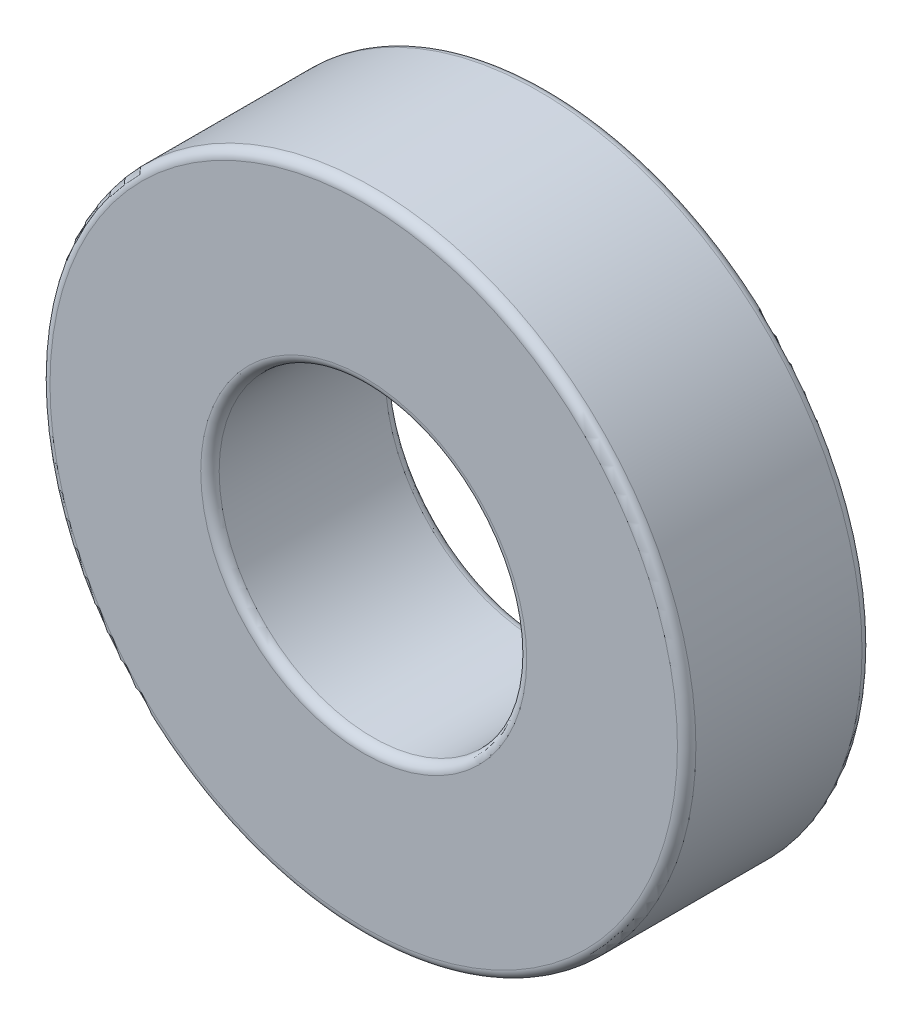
SolidWorks part; units mm, degrees
ref_plane "Face" through (0, 0, 0) normal (0, 0, 1) x (1, 0, 0)
ref_plane "Dessus" through (0, 0, 0) normal (0, 1, 0) x (1, 0, 0)
ref_plane "Droite" through (0, 0, 0) normal (1, 0, 0) x (0, 0, -1)
sketch "E_corps" plane through (0, 0, 0) normal (1, 0, 0) x (0, 0, -1)
  line L0 (-33.1757, 0) -> (55.1783, 0) construction
  line L1 (0.6, 21) -> (11.4, 21)
  line L2 (12, 20.4) -> (12, 10.6)
  line L3 (11.4, 10) -> (0.6, 10)
  line L4 (0, 10.6) -> (0, 20.4)
  line L5 (0, 50) -> (0, -50) construction
  arc A0 (0, 20.4) -> (0.6, 21) centre (0.6, 20.4) cw
  arc A1 (12, 20.4) -> (11.4, 21) centre (11.4, 20.4) ccw
  arc A2 (0.6, 10) -> (0, 10.6) centre (0.6, 10.6) cw
  arc A3 (12, 10.6) -> (11.4, 10) centre (11.4, 10.6) cw
revolve "corps" add sketch "E_corps" angle 360 about L0
sketch "E_symbole" plane through (0, 0, 0) normal (1, 0, 0) x (0, 0, -1)
  line L0 (-3.4482, 15.5) -> (19.8356, 15.5) construction
  line L1 (-33.1757, 0) -> (55.1783, 0) construction
  line L2 (1.2, 15.495) -> (1.2, 15.505)
  line L3 (1.2, 15.505) -> (5.995, 15.505)
  line L4 (1.2, 15.495) -> (5.995, 15.495)
  line L5 (5.995, 15.505) -> (5.995, 18.25)
  line L6 (5.995, 15.495) -> (5.995, 12.75)
  line L7 (5.995, 18.25) -> (6.005, 18.25)
  line L8 (5.995, 12.75) -> (6.005, 12.75)
  line L9 (6, 16.6578) -> (6, 5.8829) construction
  line L10 (6.005, 15.505) -> (6.005, 18.25)
  line L11 (10.8, 15.505) -> (6.005, 15.505)
  line L12 (10.8, 15.495) -> (10.8, 15.505)
  line L13 (10.8, 15.495) -> (6.005, 15.495)
  line L14 (6.005, 15.495) -> (6.005, 12.75)
  line L15 (12, 20.4) -> (12, 10.6) construction
  line L17 (0.6, 21) -> (11.4, 21) construction
  line L18 (0, 10.6) -> (0, 20.4) construction
  line L19 (-8.3118, 0) -> (25.8663, 0) construction
  point P7 (1.2, 15.5)
  point P16 (6, 12.75)
  point P17 (6, 18.25)
other "Symbole" parameters "D3"=15.5, "D4"=6, "D1"=360, "D7"=0
equation "\"Rayon3@E_corps\" = \"Rayon@E_corps\""
equation "\"Rayon2@E_corps\" = \"Rayon@E_corps\""
equation "\"Rayon1@E_corps\" = \"Rayon@E_corps\""
equation "\"D1@E_symbole\" = (\"Diamètre_nominal@E_corps\"+\"Diamètre_extérieur@E_corps\")/4"
equation "\"D2@E_symbole\" = 0.1*\"Largeur@E_corps\""
equation "\"D4@E_symbole\" = \"D3@E_symbole\""
equation "\"D5@E_symbole\" =   ( ( \"Diamètre_extérieur@E_corps\" - \"Diamètre_nominal@E_corps\")/2 )  * 0.25"
equation "\"D6@E_symbole\" = 0.5*\"Largeur@E_corps\""
